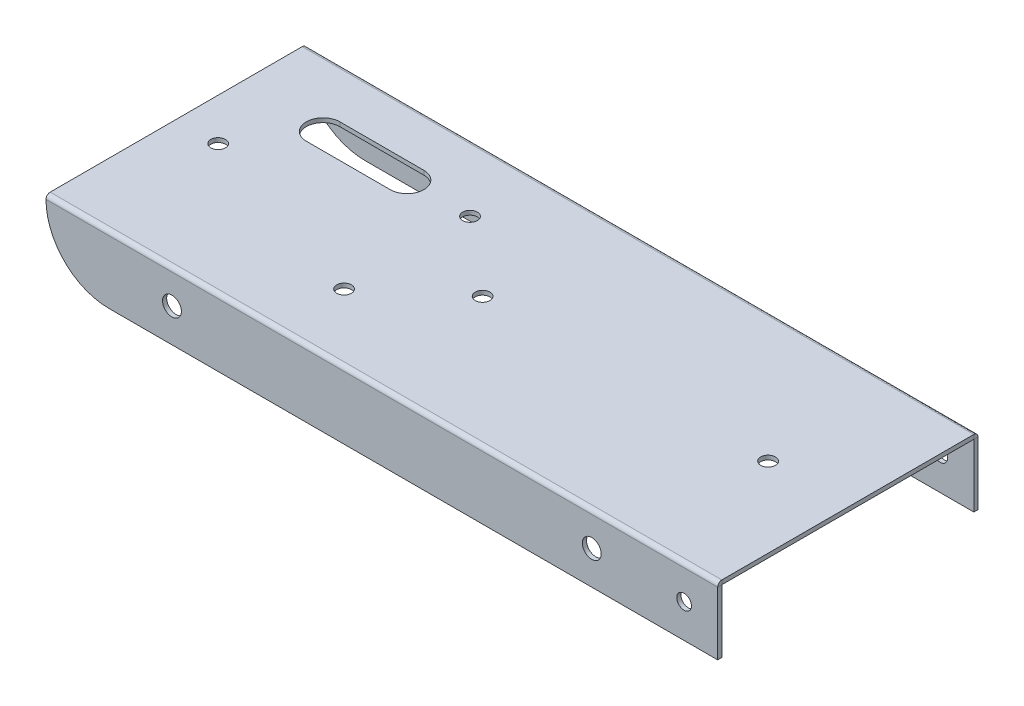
SolidWorks part; units mm, degrees
ref_plane "Front" through (0, 0, 0) normal (0, 0, 1) x (1, 0, 0)
ref_plane "Top" through (0, 0, 0) normal (0, 1, 0) x (1, 0, 0)
ref_plane "Right" through (0, 0, 0) normal (1, 0, 0) x (0, 0, -1)
sketch "Sketch1" plane through (0, 0, 0) normal (0, 1, 0) x (1, 0, 0)
  line L0 (0, 94) -> (0, 0)
  line L1 (0, 0) -> (-145, 0)
  line L2 (0, 94) -> (-145, 94)
  line L3 (-160, 79) -> (-160, 15)
  line L4 (-140, 66) -> (-120, 66)
  line L5 (-120, 58) -> (-140, 58)
  circle A0 centre (-8, 86) radius 1.75
  circle A1 centre (-8, 8) radius 1.75
  circle A2 centre (-19, 47) radius 1.75
  circle A3 centre (-30, 86) radius 2.25
  circle A4 centre (-30, 8) radius 2.25
  circle A5 centre (-87, 47) radius 1.75
  circle A6 centre (-105, 62) radius 1.75
  circle A7 centre (-105, 32) radius 1.75
  arc A8 (-120, 58) -> (-120, 66) centre (-120, 62) ccw
  arc A9 (-140, 66) -> (-140, 58) centre (-140, 62) ccw
  circle A10 centre (-130, 8) radius 2.25
  circle A11 centre (-130, 86) radius 2.25
  circle A12 centre (-150, 47) radius 1.75
  arc A13 (-160, 79) -> (-145, 94) centre (-145, 79) cw
  arc A14 (-145, 0) -> (-160, 15) centre (-145, 15) cw
  point P9 (-160, 0)
  dimension "D3" = 47
  dimension "D1" = 4
  dimension "D2" = 15
sheet metal parameters "Sheet-Metal1" thickness 1 parameters "D1"=0
base flange "Base-Flange1" sketch "Sketch1" thickness 1 reverse thickness direction yes parameters "D1"=0
sketch "Sketch3" plane through (0, 1, 0) normal (0, 1, 0) x (-1, 0, 0)
  line L4 (0, -78) -> (160, -78)
  line L5 (0, -16) -> (160, -16)
sketched bend "Sketched Bend1" parameters "D1"=0
bend "SketchBend1" bend radius 0 bend angle 90 parameters "D5"=1
bend "SketchBend2" bend radius 0 bend angle 90 parameters "D5"=2
flat pattern "Flat-Pattern1"
sketch "Bend-Lines1" plane through (0, 1, 0) normal (0, 1, 0) x (-1, 0, 0)
  line L0 (160, -16) -> (0, -16) construction
  line L1 (0, -78) -> (160, -78) construction
bend of the flat pattern "Flatten-<SketchBend1>1"
bend of the flat pattern "Flatten-<SketchBend2>1"
